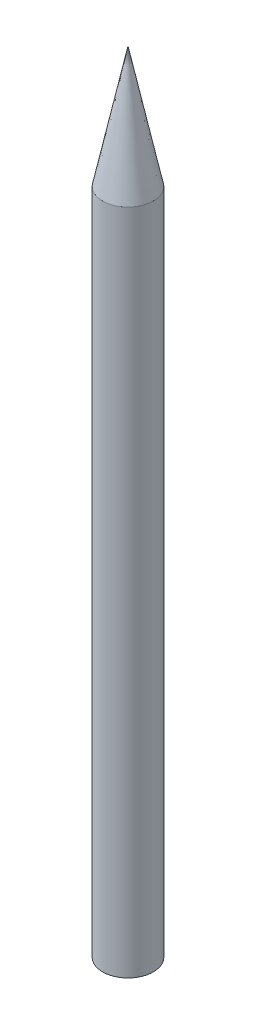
SolidWorks part; units mm, degrees
ref_plane "Front Plane" through (0, 0, 0) normal (0, 0, 1) x (1, 0, 0)
ref_plane "Top Plane" through (0, 0, 0) normal (0, 1, 0) x (1, 0, 0)
ref_plane "Right Plane" through (0, 0, 0) normal (1, 0, 0) x (0, 0, -1)
sketch "Sketch1" plane through (0, 0, 0) normal (0, 1, 0) x (1, 0, 0)
  circle A0 centre (0, 0) radius 5.3
  dimension "D1" = 10.6
extrude "Boss-Extrude1" add sketch "Sketch1" along normal blind 139.7
ref_axis "Axis1" through (0, 0, 0) along (0, 1, 0)
sketch "Sketch2" plane through (0, 0, 0) normal (1, 0, 0) x (0, 0, -1)
  line L0 (0, 139.7419) -> (5.3, 139.7)
  line L1 (0, 0) -> (0, 230.089) construction
  line L2 (5.3, 139.7) -> (0, 165.1419)
  line L3 (0, 165.1419) -> (0, 139.7419)
  dimension "D1" = 25.4
revolve "Revolve1" add sketch "Sketch2" angle 360 about axis through (0, 0, 0) along (0, 1, 0)
